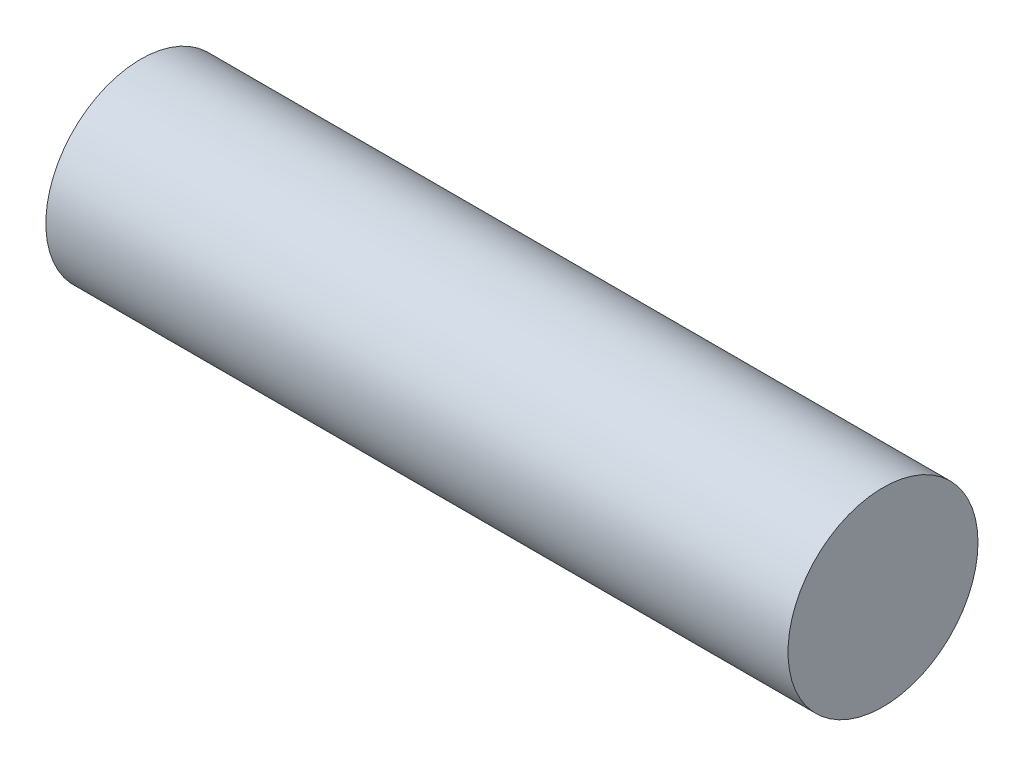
SolidWorks part; units mm, degrees
ref_plane "Спереди" through (0, 0, 0) normal (0, 0, 1) x (1, 0, 0)
ref_plane "Сверху" through (0, 0, 0) normal (0, 1, 0) x (1, 0, 0)
ref_plane "Справа" through (0, 0, 0) normal (1, 0, 0) x (0, 0, -1)
sketch "Эскиз1" plane through (0, 0, 0) normal (1, 0, 0) x (0, 0, -1)
  circle A0 centre (0, 0) radius 0.6502
  dimension "D1" = 1.3005
extrude "Бобышка-Вытянуть1" add sketch "Эскиз1" along normal mid plane 5.08
